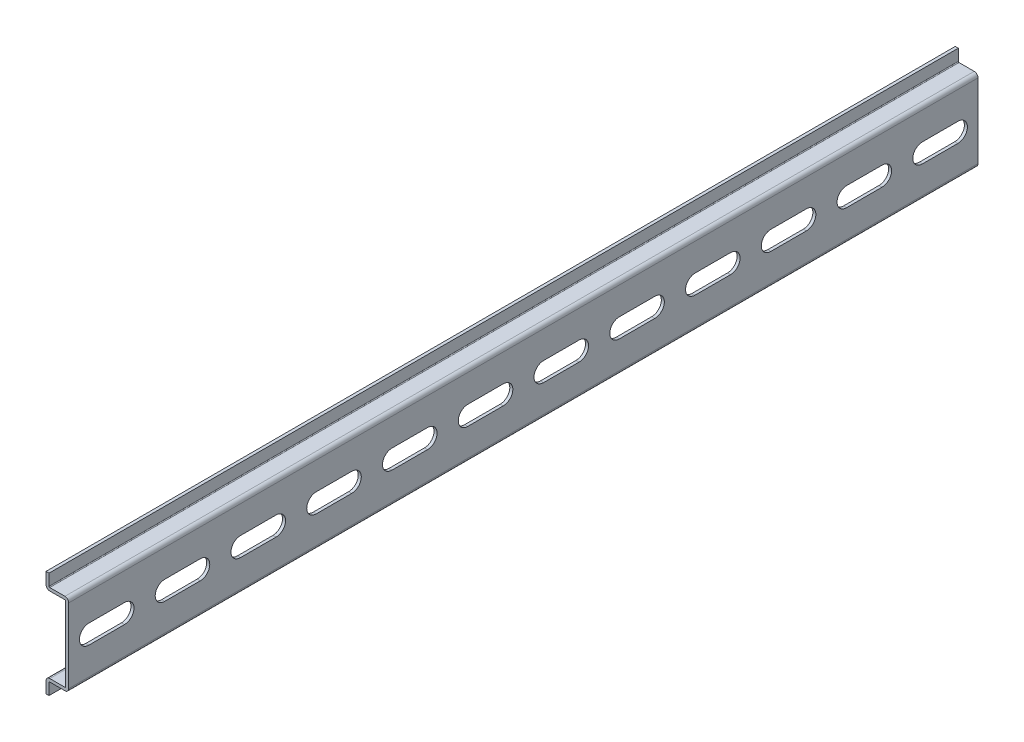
SolidWorks part; units mm, degrees
ref_plane "Front Plane" through (0, 0, 0) normal (0, 0, 1) x (1, 0, 0)
ref_plane "Top Plane" through (0, 0, 0) normal (0, 1, 0) x (1, 0, 0)
ref_plane "Right Plane" through (0, 0, 0) normal (1, 0, 0) x (0, 0, -1)
sketch "Sketch1" plane through (0, 0, 0) normal (0, 0, 1) x (1, 0, 0)
  line L0 (0, -13.5) -> (0, 13.5) construction
  line L1 (0, 13.5) -> (-6.5, 13.5) construction
  line L2 (-6.5, 13.5) -> (-6.5, 17.5) construction
  line L3 (0, -13.5) -> (-6.5, -13.5) construction
  line L4 (-6.5, -13.5) -> (-6.5, -17.5) construction
  line L5 (-7.5, 0) -> (0, 0) construction
  line L6 (-6.5, 17.5) -> (-7.5, 17.5) construction
  line L7 (-7.5, 0) -> (-7.5, 17.5) construction
sketch "Sketch2" plane through (0, 0, 0) normal (1, 0, 0) x (0, 0, -1)
  line L0 (0, 0) -> (-300.0375, 0) construction
  line L1 (-62.5, 17.5) -> (-62.5, -17.5) construction
  line L2 (-237.5375, 17.5) -> (-237.5375, -17.5) construction
  line L3 (-62.5, 17.5) -> (-237.5375, 17.5) construction
  line L4 (-150.0188, 0) -> (-150.0188, 17.5) construction
  point P8 (-237.5375, 0)
  point P9 (-62.5, 0)
  point P14 (-150.0188, 17.5)
sketch "Sketch3" plane through (0, 0, 0) normal (0, 0, 1) x (1, 0, 0)
  line L0 (-6.5, -13.5) -> (-6.5, -17.5) construction
  line L1 (0, -13.5) -> (-6.5, -13.5) construction
  line L2 (0, -13.5) -> (0, 13.5) construction
  line L3 (0, 13.5) -> (-6.5, 13.5) construction
  line L4 (-6.5, 13.5) -> (-6.5, 17.5) construction
  line L5 (-6.5, -13.5) -> (-6.5, -17.5)
  line L6 (0, -13.5) -> (-6.5, -13.5)
  line L7 (0, -13.5) -> (0, 13.5)
  line L8 (0, 13.5) -> (-6.5, 13.5)
  line L9 (-6.5, 13.5) -> (-6.5, 17.5)
extrude "Extrude-Thin1" add sketch "Sketch3" along normal up to vertex (300.0375 mm away) thin
sketch "Sketch4" plane through (0, 0, 0) normal (1, 0, 0) x (0, 0, -1)
  line L0 (0, 0) -> (-62.1077, 0) construction
  line L1 (-6.65, 0) -> (-18.35, 0) construction
  line L2 (-6.65, -3.15) -> (-18.35, -3.15)
  line L3 (-6.65, 3.15) -> (-18.35, 3.15)
  arc A0 (-6.65, -3.15) -> (-6.65, 3.15) centre (-6.65, 0) ccw
  arc A1 (-18.35, 3.15) -> (-18.35, -3.15) centre (-18.35, 0) ccw
  point P5 (-12.5, 0)
  point P10 (-3.5, 0)
  point P11 (-21.5, 0)
  point P12 (-37.5, 0)
extrude "Cut-Extrude1" cut sketch "Sketch4" against normal through all both and the other way through all
pattern_linear "LPattern1" count 48 spacing 25 along (0, 0, 1) of "Cut-Extrude1"
fillet "Fillet1" radius 0.25 4 edges at (-6.5, 13.5, 150.0188) (-6.5, -13.5, 150.0188) (-1, 12.5, 150.0188) (-1, -12.5, 150.0188)
fillet "Fillet2" radius 1.25 4 edges at (-7.5, -12.5, 150.0188) (0, -13.5, 150.0188) (0, 13.5, 150.0188) (-7.5, 12.5, 150.0188)
ref_plane "Contact Plane 1" through (-1, 0, 0) normal (-1, 0, 0) x (0, 0, 1)
equation "\"D3@LPattern1\" = \"Mounting Hole C to C@Sketch4\""
equation "\"D5@Extrude-Thin1\"=\"Metal Thickness@Sketch1\""
equation "\"D3@Sketch4\"=\"Mounting Hole C to C@Sketch4\"/2"
equation "\"D1@LPattern1\"=\"Length@Sketch2\"/\"Mounting Hole Diameter@Sketch4\""
